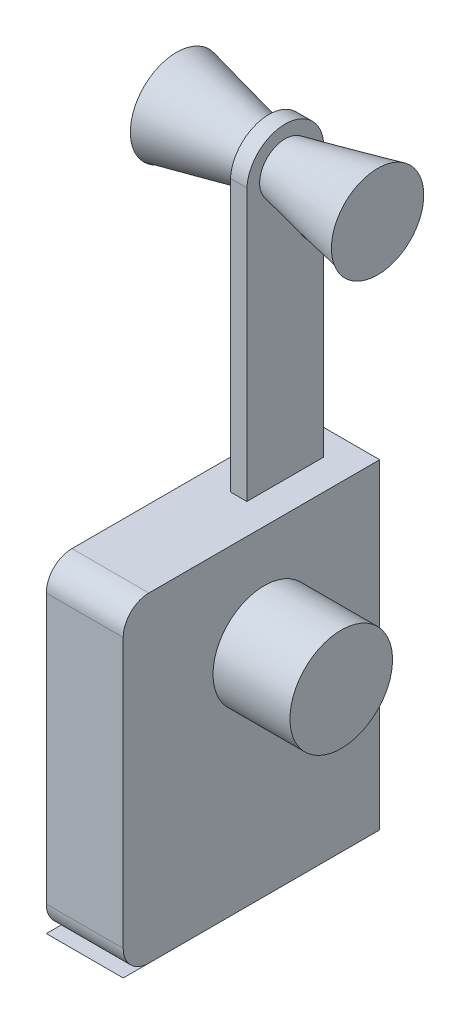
SolidWorks part; units mm, degrees
ref_plane "Front Plane" through (0, 0, 0) normal (0, 0, 1) x (1, 0, 0)
ref_plane "Top Plane" through (0, 0, 0) normal (0, 1, 0) x (1, 0, 0)
ref_plane "Right Plane" through (0, 0, 0) normal (1, 0, 0) x (0, 0, -1)
sketch "Sketch2" plane through (0, 0, 0) normal (0, 0, 1) x (1, 0, 0)
  line L0 (0, 0) -> (0, 79.375)
  line L1 (0, 79.375) -> (-19.05, 79.375)
  line L2 (-19.05, 79.375) -> (-19.05, 47.625)
  line L3 (-19.05, 47.625) -> (-33.528, 47.625)
  line L4 (-38.1, 43.053) -> (-38.1, 4.572)
  line L5 (-33.528, 0) -> (0, 0)
  line L6 (-38.1, 47.625) -> (-32.4439, 47.625)
  line L8 (-38.1, 47.625) -> (-31.75, 47.625)
  line L9 (-38.1, 47.625) -> (-38.1, 41.1995)
  line L12 (-38.1, 0) -> (-31.75, 0)
  line L13 (-38.1, 0) -> (-38.1, 6.35)
  circle A0 centre (-31.75, 6.35) radius 2.286
  circle A1 centre (-31.75, 41.275) radius 2.286
  arc A2 (-33.528, 47.625) -> (-38.1, 43.053) centre (-33.528, 43.053) ccw
  arc A3 (-38.1, 4.572) -> (-33.528, 0) centre (-33.528, 4.572) ccw
  dimension "D1" = 4.572
extrude "Boss-Extrude1" add sketch "Sketch2" along normal blind 5.08 contours L4 A3 L5 L0 L1 L2 L3 A2 A1 A0
sketch "Sketch3" plane through (0, 0, 5.08) normal (0, 0, 1) x (1, 0, 0)
  line L1 (-19.05, 79.375) -> (0, 79.375)
  line L2 (-19.05, 79.375) -> (-19.05, 0)
  line L3 (-19.05, 0) -> (0, 0)
  line L4 (0, 79.375) -> (0, 0)
extrude "Boss-Extrude2" add sketch "Sketch3" along normal blind 58.42
sketch "Sketch4" plane through (0, 0, 0) normal (1, 0, 0) x (0, 0, -1)
  line L0 (-63.5, 6.35) -> (-63.5, 0)
  line L1 (-57.15, 79.375) -> (0, 79.375)
  line L2 (-63.5, 73.025) -> (-63.5, 6.35)
  line L3 (-57.15, 0) -> (0, 0)
  line L4 (0, 79.375) -> (0, 0)
  line L5 (-63.5, 0) -> (-57.2486, 0.0008)
  arc A0 (-63.5, 6.35) -> (-57.15, 0) centre (-57.15, 6.35) ccw
  arc A1 (-57.15, 79.375) -> (-63.5, 73.025) centre (-57.15, 73.025) ccw
  point P10 (-63.5, 79.375)
  dimension "D1" = 6.35
extrude "Cut-Extrude1" cut sketch "Sketch4" against normal blind 58.42 contours A0 L5 M9 | A1 M8 M9
sketch "Sketch5" plane through (0, 0, 0) normal (1, 0, 0) x (0, 0, -1)
  circle A0 centre (-28.575, 53.975) radius 12.7
extrude "Boss-Extrude3" add sketch "Sketch5" along normal blind 19.05
sketch "Sketch6" plane through (0, 79.375, 0) normal (0, 1, 0) x (1, 0, 0)
  line L2 (-7.493, -25.4) -> (-11.557, -25.4)
  line L3 (-11.557, -25.4) -> (-11.557, -6.3867)
  line L4 (-11.557, -6.3867) -> (-7.493, -6.3867)
  line L5 (-7.493, -25.4) -> (-7.493, -6.3867)
  point P9 (-9.525, -6.3867)
extrude "Boss-Extrude4" add sketch "Sketch6" along normal blind 76.2
sketch "Sketch7" plane through (-7.493, 0, 0) normal (1, 0, 0) x (0, 0, -1)
  line L0 (-15.8933, 155.575) -> (-15.8933, 146.05)
  line L1 (-25.4, 155.575) -> (-6.3867, 155.575) construction
  circle A0 centre (-15.8933, 146.05) radius 9.525
extrude "Cut-Extrude2" cut sketch "Sketch7" against normal blind 76.2 contours A0 M5 M6 | A0 M4 M5
sketch "Sketch8" plane through (-7.493, 0, 0) normal (1, 0, 0) x (0, 0, -1)
  circle A0 centre (-15.8933, 146.05) radius 6.35
sketch3d "3DSketch1"
  point P3 (0, 0, 0)
sketch "Sketch9" plane through (15.367, 0, 0) normal (1, 0, 0) x (0, 0, -1)
  circle A1 centre (-15.8933, 146.05) radius 11.43
loft "Loft1" add profiles "Sketch8", "Sketch9"
sketch "Sketch15" plane through (-11.557, 0, 0) normal (-1, 0, 0) x (0, 0, 1)
  circle A0 centre (15.8933, 146.05) radius 6.35
sketch3d "3DSketch2" plane through (0, 0, 0) normal (0, 0, 1) x (1, 0, 0)
  dimension "D1" = 22.86
sketch "Sketch16" plane through (-34.417, 0, 0) normal (-1, 0, 0) x (0, 0, 1)
  circle A0 centre (15.8933, 146.05) radius 11.43
loft "Loft2" add profiles "Sketch16", "Sketch15"
